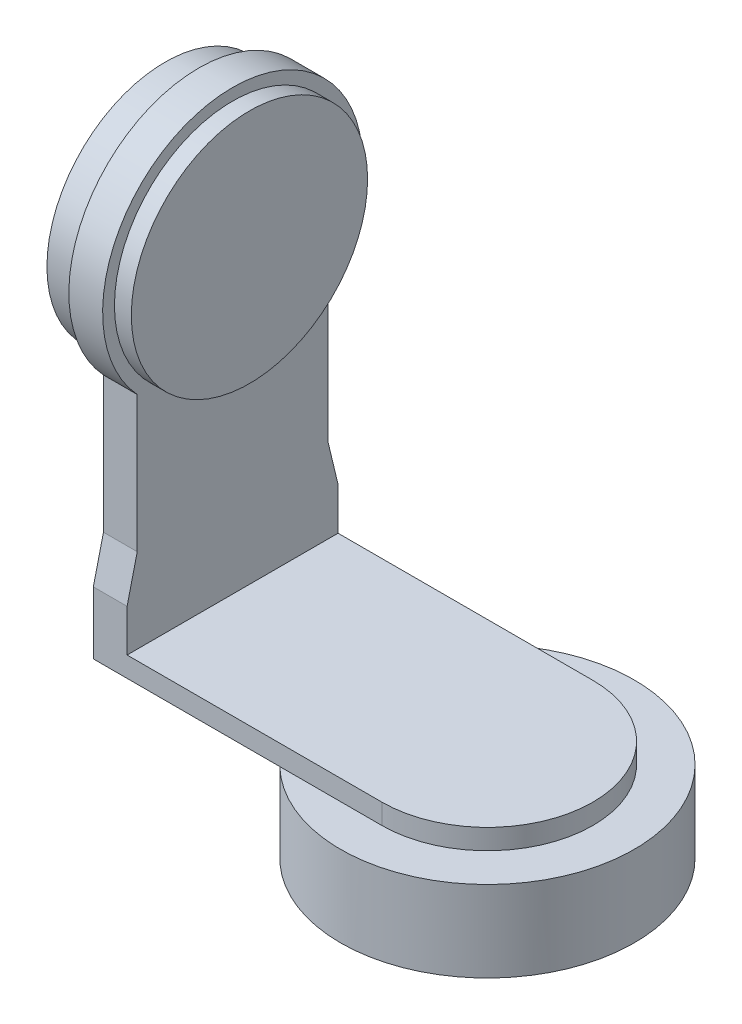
SolidWorks part; units mm, degrees
ref_plane "Front Plane" through (0, 0, 0) normal (0, 0, 1) x (1, 0, 0)
ref_plane "Top Plane" through (0, 0, 0) normal (0, 1, 0) x (1, 0, 0)
ref_plane "Right Plane" through (0, 0, 0) normal (1, 0, 0) x (0, 0, -1)
sketch "Sketch1" plane through (0, 0, 0) normal (0, 1, 0) x (1, 0, 0)
  circle A0 centre (0, 0) radius 17.4
  dimension "D1" = 34.8
extrude "Boss-Extrude1" add sketch "Sketch1" along normal blind 9.6
sketch "Sketch2" plane through (0, 9.6, 0) normal (0, 1, 0) x (1, 0, 0)
  line L0 (0, -12.5) -> (-34.2, -12.5)
  line L1 (-34.2, -12.5) -> (-34.2, 12.5)
  line L2 (-34.2, 12.5) -> (0, 12.5)
  arc A0 (0, -12.5) -> (0, 12.5) centre (0, 0) ccw
  dimension "D1" = 25
  dimension "D2" = 34.2
extrude "Boss-Extrude2" add sketch "Sketch2" along normal blind 2.4
sketch "Sketch5" plane through (-34.2, 0, 0) normal (-1, 0, 0) x (0, 0, 1)
  line L0 (0, 12) -> (0, 64) construction
  line L1 (-12.5, 12) -> (12.5, 12) construction
  line L2 (11.3, 22) -> (11.3, 38.1372)
  line L3 (-11.3, 22) -> (-11.3, 38.1372)
  line L4 (-12.5, 12) -> (-12.5, 17)
  line L5 (-12.5, 17) -> (-11.3, 22)
  line L6 (12.5, 12) -> (12.5, 17)
  line L7 (12.5, 17) -> (11.3, 22)
  line L8 (12.5, 12) -> (-12.5, 12)
  arc A0 (11.3, 38.1372) -> (-11.3, 38.1372) centre (0, 48.6) ccw
  dimension "D2" = 30.8
  dimension "D1" = 52
  dimension "D3" = 11.3
  dimension "D4" = 5
  dimension "D5" = 10
extrude "Boss-Extrude3" add sketch "Sketch5" against normal blind 4
sketch "Sketch6" plane through (-34.2, 0, 0) normal (-1, 0, 0) x (0, 0, 1)
  circle A0 centre (0, 48.6) radius 14
  arc A1 (11.3, 38.1372) -> (-11.3, 38.1372) centre (0, 48.6) ccw construction
extrude "Boss-Extrude4" add sketch "Sketch6" along normal blind 4
sketch "Sketch7" plane through (-30.2, 0, 0) normal (1, 0, 0) x (0, 0, -1)
  circle A0 centre (0, 48.6) radius 14
  arc A1 (11.3, 38.1372) -> (-11.3, 38.1372) centre (0, 48.6) ccw construction
extrude "Boss-Extrude5" add sketch "Sketch7" along normal blind 2
